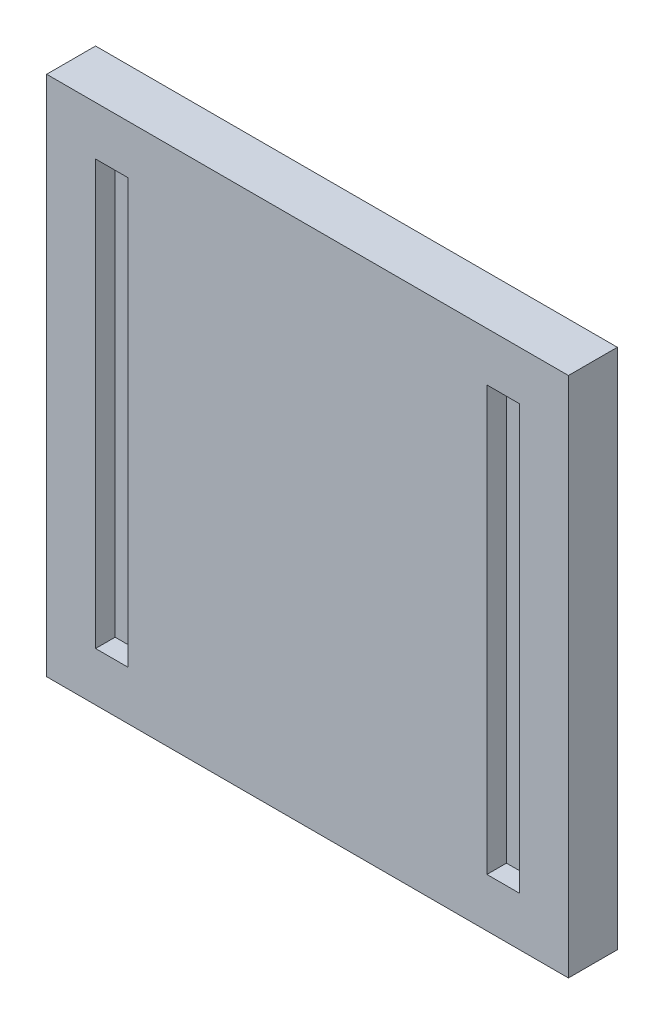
SolidWorks part; units mm, degrees
ref_plane "Face" through (0, 0, 0) normal (0, 0, 1) x (1, 0, 0)
ref_plane "Dessus" through (0, 0, 0) normal (0, 1, 0) x (1, 0, 0)
ref_plane "Droite" through (0, 0, 0) normal (1, 0, 0) x (0, 0, -1)
sketch "Esquisse1" plane through (0, 0, 0) normal (0, 0, 1) x (1, 0, 0)
  line L1 (-96.478, 0) -> (63.522, 0)
  line L2 (-96.478, 0) -> (-96.478, -160)
  line L3 (-96.478, -160) -> (63.522, -160)
  line L4 (63.522, 0) -> (63.522, -160)
  dimension "D1" = 160
  dimension "D2" = 160
extrude "Base-Extrusion" add sketch "Esquisse1" along normal blind 15
sketch "Esquisse2" plane through (0, 0, 15) normal (0, 0, 1) x (1, 0, 0)
  line L0 (63.522, 0) -> (-96.478, 0) construction
  line L1 (-81.478, -15) -> (-71.478, -15)
  line L2 (-81.478, -15) -> (-81.478, -145)
  line L3 (-81.478, -145) -> (-71.478, -145)
  line L4 (-71.478, -15) -> (-71.478, -145)
  line L5 (38.522, -15) -> (48.522, -15)
  line L6 (38.522, -15) -> (38.522, -145)
  line L7 (38.522, -145) -> (48.522, -145)
  line L8 (48.522, -15) -> (48.522, -145)
  line L9 (-96.478, 0) -> (-96.478, -160) construction
  dimension "D1" = 15
  dimension "D2" = 10
  dimension "D3" = 130
  dimension "D4" = 130
  dimension "D5" = 110
  dimension "D6" = 15
  dimension "D7" = 10
  dimension "D8" = 15
extrude "Enlèv. mat.-Extru.2" cut sketch "Esquisse2" against normal blind 6
